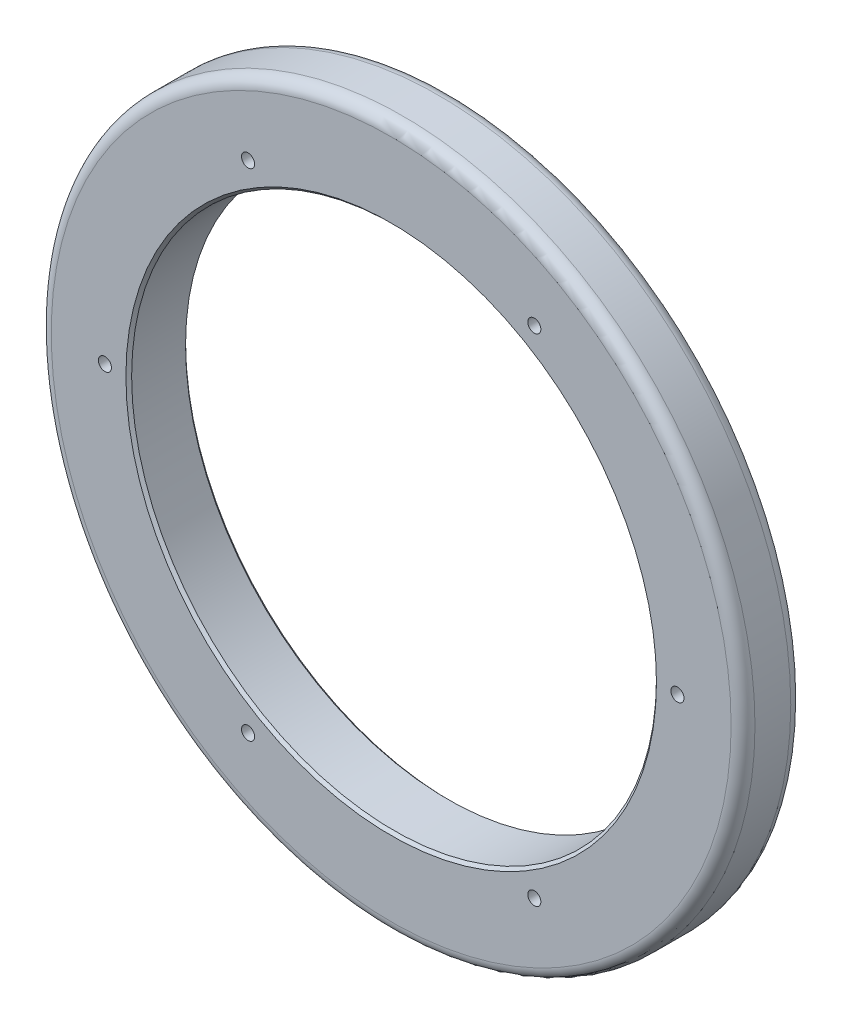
SolidWorks part; units mm, degrees
ref_plane "Front" through (0, 0, 0) normal (0, 0, 1) x (1, 0, 0)
ref_plane "Top" through (0, 0, 0) normal (0, 1, 0) x (1, 0, 0)
ref_plane "Right" through (0, 0, 0) normal (1, 0, 0) x (0, 0, -1)
sketch "Sketch1" plane through (0, 0, 0) normal (0, 0, 1) x (1, 0, 0)
  circle A0 centre (0, 0) radius 93.6625
  circle A1 centre (0, 0) radius 69.85
  dimension "D1" = 187.325
  dimension "D2" = 139.7
extrude "Base-Extrude" add sketch "Sketch1" along normal blind 15.875
fillet "Fillet1" radius 3.175
sketch "Sketch2" plane through (0, 0, 15.875) normal (0, 0, 1) x (1, 0, 0)
  circle A0 centre (-38.1, 65.9911) radius 1.7399
  circle A1 centre (76.2, 0) radius 1.7399
  circle A2 centre (38.1, 65.9911) radius 1.7399
  circle A3 centre (38.1, -65.9911) radius 1.7399
  circle A4 centre (-38.1, -65.9911) radius 1.7399
  circle A5 centre (-76.2, 0) radius 1.7399
  dimension "D1" = 3.4798
  dimension "D2" = 3.4798
  dimension "D3" = 3.4798
  dimension "D4" = 3.4798
  dimension "D5" = 3.4798
  dimension "D6" = 3.4798
extrude "Cut-Extrude1" cut sketch "Sketch2" against normal blind 15.875
chamfer "Chamfer1" distance 0.762 angle 45
